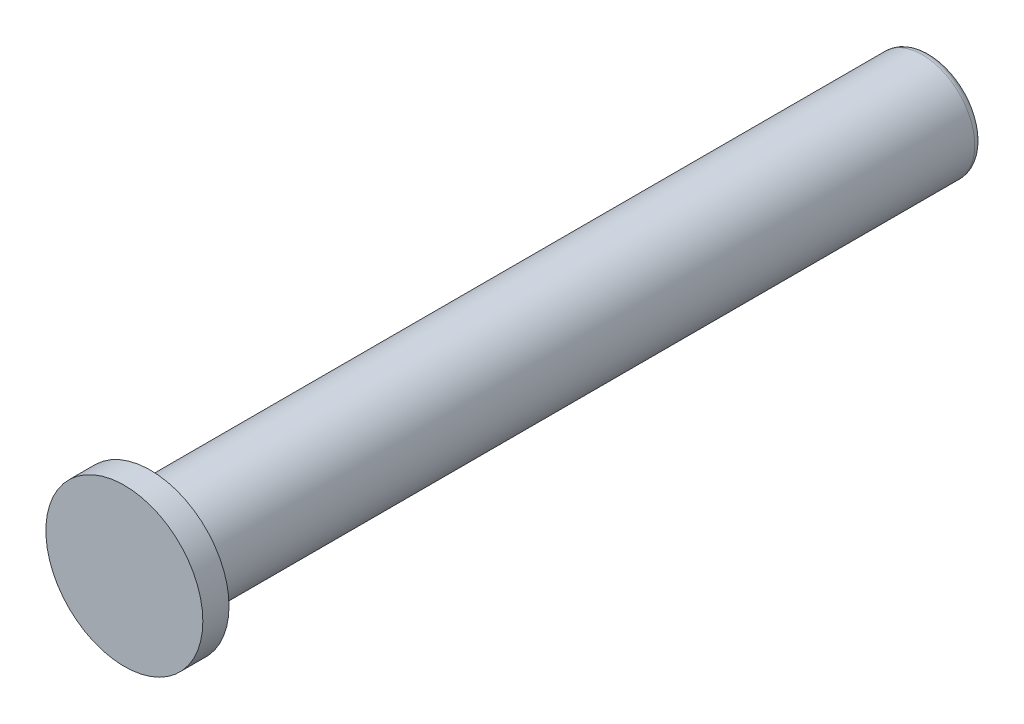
SolidWorks part; units mm, degrees
ref_plane "Front Plane" through (0, 0, 0) normal (0, 0, 1) x (1, 0, 0)
ref_plane "Top Plane" through (0, 0, 0) normal (0, 1, 0) x (1, 0, 0)
ref_plane "Right Plane" through (0, 0, 0) normal (1, 0, 0) x (0, 0, -1)
sketch "Sketch1" plane through (0, 0, 0) normal (1, 0, 0) x (0, 0, -1)
  line L0 (0, 0) -> (154, 0) construction
  line L1 (0, 0) -> (0, 15)
  line L2 (0, 15) -> (5, 15)
  line L3 (5, 15) -> (5, 10)
  line L4 (5, 10) -> (152.5, 10)
  line L5 (154, 8.5) -> (154, 0)
  line L6 (0, 0) -> (154, 0)
  arc A0 (152.5, 10) -> (154, 8.5) centre (152.5, 8.5) cw
  point P9 (154, 10)
  dimension "D5" = 1.5
  dimension "D1" = 5
  dimension "D2" = 15
  dimension "D3" = 10
  dimension "D4" = 149
revolve "Revolve1" add sketch "Sketch1" angle 360 about L0
sketch "Sketch3" plane through (0, 0, 0) normal (1, 0, 0) x (0, 0, -1)
  line L0 (154, 0) -> (146.9899, 0) construction
  line L1 (154, -10) -> (154, 10) construction
  line L2 (154, 3) -> (154, 0)
  line L3 (153.5, 2.5) -> (148, 2.5)
  line L4 (148, 2.5) -> (146.9899, 0)
  line L5 (153.5, 2.5) -> (154, 3)
  line L6 (154, 0) -> (146.9899, 0)
  dimension "D1" = 68
  dimension "D2" = 45
  dimension "D3" = 2.5
  dimension "D4" = 0.5
  dimension "D5" = 6
revolve "Cut-Revolve1" cut sketch "Sketch3" angle 360 about L0
